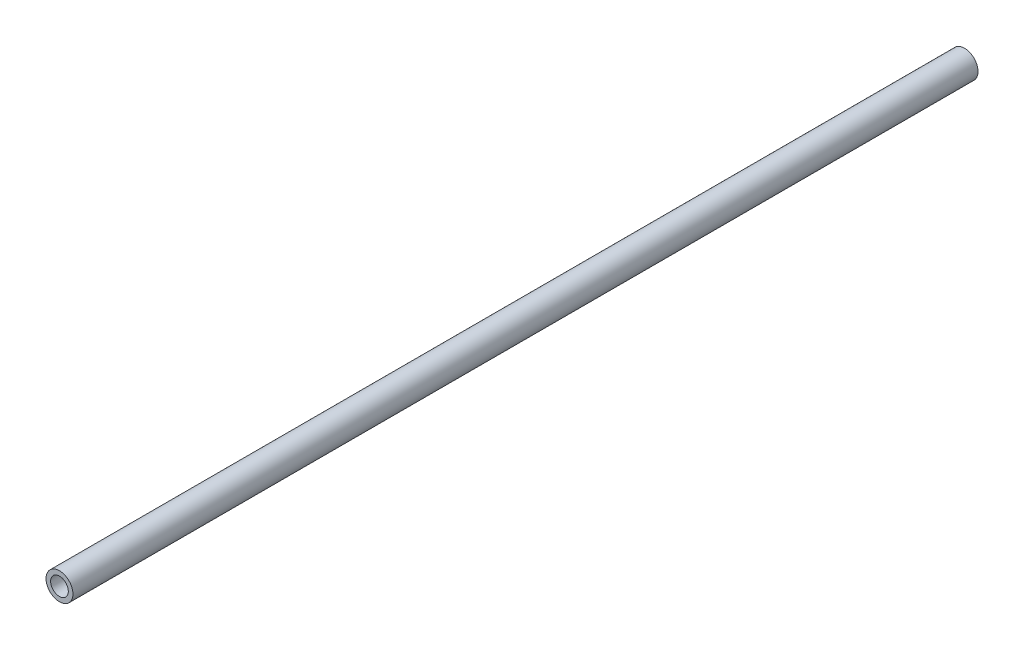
SolidWorks part; units mm, degrees
ref_plane "Plan de face" through (0, 0, 0) normal (0, 0, 1) x (1, 0, 0)
ref_plane "Plan de dessus" through (0, 0, 0) normal (0, 1, 0) x (1, 0, 0)
ref_plane "Plan de droite" through (0, 0, 0) normal (1, 0, 0) x (0, 0, -1)
sketch "Esquisse1" plane through (0, 0, 0) normal (0, 0, 1) x (1, 0, 0)
  circle A0 centre (0, 0) radius 3.05
  circle A1 centre (0, 0) radius 2
  dimension "D1" = 4
  dimension "D2" = 6.1
extrude "Boss.-Extru.1" add sketch "Esquisse1" along normal blind 205
ref_plane "sym Transversal" through (0, 0, 102.5) normal (0, 0, -1) x (-1, 0, 0)
